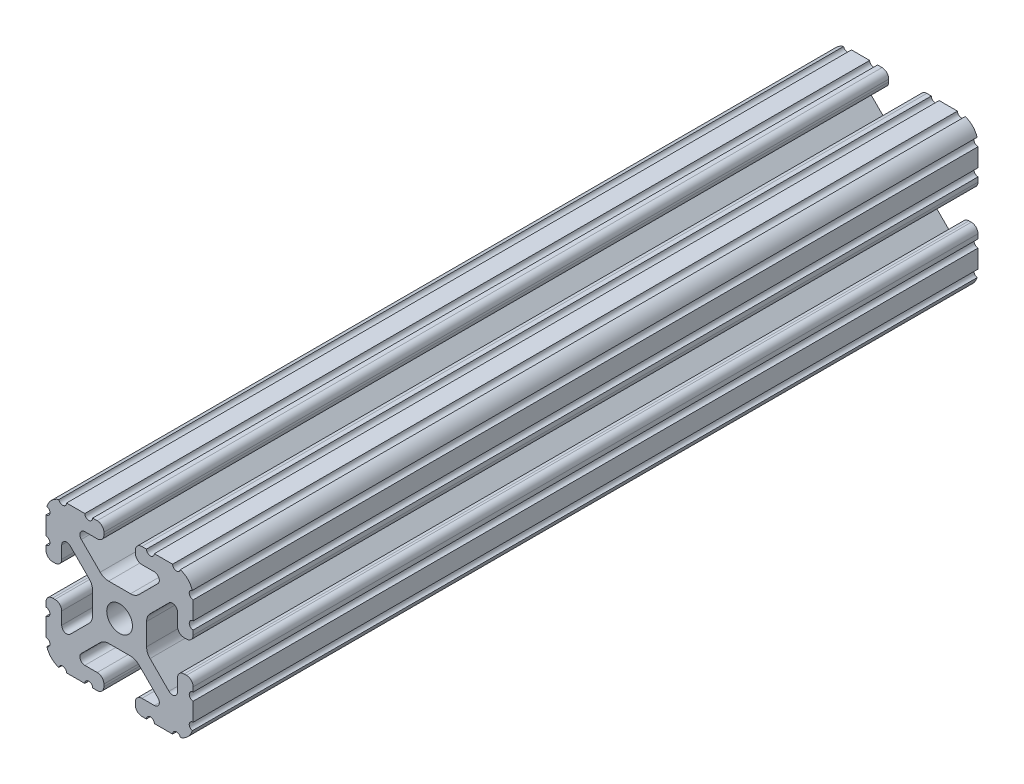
SolidWorks part; units mm, degrees
ref_plane "Front Plane" through (0, 0, 0) normal (0, 0, 1) x (1, 0, 0)
ref_plane "Top Plane" through (0, 0, 0) normal (0, 1, 0) x (1, 0, 0)
ref_plane "Right Plane" through (0, 0, 0) normal (1, 0, 0) x (0, 0, -1)
sketch "Sketch2" plane through (0, 0, 0) normal (0, 0, 1) x (1, 0, 0)
  line L0 (0, 19.05) -> (0, -19.05) construction
  line L1 (-19.05, 0) -> (19.05, 0) construction
  line L2 (4.064, -19.05) -> (19.05, -19.05)
  line L3 (19.05, -19.05) -> (19.05, -4.064)
  line L4 (4.064, -19.05) -> (4.064, -14.986)
  line L5 (4.064, -14.986) -> (12.1123, -14.986)
  line L6 (12.1123, -14.986) -> (4.1113, -6.985)
  line L7 (0, 0) -> (19.05, -19.05) construction
  line L8 (19.05, -4.064) -> (14.986, -4.064)
  line L9 (14.986, -4.064) -> (14.986, -12.1123)
  line L10 (14.986, -12.1123) -> (6.985, -4.1113)
  circle A0 centre (0, 0) radius 3.3274
  arc A1 (8.9963, -14.986) -> (9.909, -12.7826) centre (8.9963, -13.6953) ccw construction
  point P8 (0, -6.985)
sketch "Sketch3" plane through (0, 0, 0) normal (1, 0, 0) x (0, 0, -1)
  line L0 (-457.2, -19.05) -> (457.2, -19.05) construction
  line L1 (-431.8, 0) -> (431.8, 0) construction
sketch "Sketch4" plane through (0, 0, 0) normal (0, 0, 1) x (1, 0, 0)
  line L0 (5.7912, -19.05) -> (14.3002, -19.05)
  line L1 (4.064, -19.05) -> (19.05, -19.05) construction
  line L2 (4.064, -19.05) -> (4.064, -14.986) construction
  line L3 (4.064, -14.986) -> (12.1123, -14.986) construction
  line L4 (4.064, -16.7132) -> (4.064, -17.3228)
  line L5 (5.7912, -14.986) -> (8.9963, -14.986)
  line L6 (0, -6.985) -> (2.833, -6.985)
  line L7 (12.1123, -14.986) -> (4.1113, -6.985) construction
  line L8 (5.0152, -7.8889) -> (9.909, -12.7826)
  line L9 (19.05, -19.05) -> (19.05, -4.064) construction
  line L10 (14.986, -12.1123) -> (6.985, -4.1113) construction
  line L11 (14.986, -4.064) -> (14.986, -12.1123) construction
  line L12 (14.986, -8.9963) -> (14.986, -5.7912)
  line L13 (19.05, -4.064) -> (14.986, -4.064) construction
  line L14 (16.7132, -4.064) -> (17.3228, -4.064)
  line L15 (19.05, -5.7912) -> (19.05, -14.3002)
  line L16 (12.7826, -9.909) -> (7.8889, -5.0152)
  line L17 (6.985, 0) -> (6.985, -2.833)
  line L18 (-19.05, 0) -> (19.05, 0) construction
  line L19 (0, -6.985) -> (0, -3.3274)
  line L20 (0, 19.05) -> (0, -19.05) construction
  line L21 (6.985, 0) -> (3.3274, 0)
  arc A0 (4.064, -17.3228) -> (5.7912, -19.05) centre (5.7912, -17.3228) ccw
  arc A2 (4.064, -16.7132) -> (5.7912, -14.986) centre (5.7912, -16.7132) cw
  arc A3 (8.9963, -14.986) -> (9.909, -12.7826) centre (8.9963, -13.6953) ccw
  arc A4 (2.833, -6.985) -> (5.0152, -7.8889) centre (2.833, -10.0711) cw
  arc A5 (14.3002, -19.05) -> (19.05, -14.3002) centre (14.3002, -14.3002) ccw
  arc A6 (12.7826, -9.909) -> (14.986, -8.9963) centre (13.6953, -8.9963) ccw
  arc A7 (14.986, -5.7912) -> (16.7132, -4.064) centre (16.7132, -5.7912) cw
  arc A8 (17.3228, -4.064) -> (19.05, -5.7912) centre (17.3228, -5.7912) cw
  arc A9 (7.8889, -5.0152) -> (6.985, -2.833) centre (10.0711, -2.833) cw
  circle A10 centre (0, 0) radius 3.3274 construction
  arc A11 (0, -3.3274) -> (3.3274, 0) centre (0, 0) ccw
extrude "Boss-Extrude1" add sketch "Sketch4" along normal mid plane 914.4
sketch "Sketch5" plane through (0, 0, 0) normal (0, 0, 1) x (1, 0, 0)
  line L0 (4.064, -19.05) -> (19.05, -19.05) construction
  line L1 (5.7912, -14.986) -> (8.9963, -14.986) construction
  line L3 (0, 0) -> (19.05, -19.05) construction
  line L4 (8.9963, -14.986) -> (8.9963, -19.05) construction
  line L5 (12.1123, -14.986) -> (4.1113, -6.985) construction
  circle A0 centre (14.7395, -19.05) radius 1.016
  circle A1 centre (7.9803, -19.05) radius 1.016
  circle A2 centre (19.05, -14.7395) radius 1.016
  circle A3 centre (19.05, -7.9803) radius 1.016
  point P10 (7.3938, -14.986)
  point P12 (13.6953, -8.9963)
extrude "Cut-Extrude1" cut sketch "Sketch5" against normal through all both and the other way through all
mirror "Mirror1" about plane through (0, 0, 0) normal (1, 0, 0)
mirror "Mirror2" about plane through (0, 0, 0) normal (0, 1, 0)
sketch "Sketch6" plane through (0, 0, 457.2) normal (0, 0, 1) x (1, 0, 0)
  line L1 (19.5673, -19.4887) -> (-19.5673, -19.4887)
  line L2 (19.5673, -19.4887) -> (19.5673, 19.4887)
  line L3 (19.5673, 19.4887) -> (-19.5673, 19.4887)
  line L4 (-19.5673, -19.4887) -> (-19.5673, 19.4887)
  line L5 (19.5673, -19.4887) -> (-19.5673, 19.4887) construction
  line L6 (19.5673, 19.4887) -> (-19.5673, -19.4887) construction
  point P0 (0, 0)
extrude "Cut-Extrude2" cut sketch "Sketch6" against normal offset from surface (711.2 mm away) 203.2
equation "\"D1@Boss-Extrude1\"=\"Length@Sketch3\""
equation "\"D1@Sketch2\"=\"Thickness@Sketch2\""
equation "\"D2@Sketch4\"=\"Slot Inner Width@Sketch2\"*0.15"
equation "\"D1@Sketch4\"=\"D3@Sketch4\"*2.75"
equation "\"D3@Sketch4\"=\"Thickness@Sketch2\"*0.425"
equation "\"D1@Sketch5\"=\"Thickness@Sketch2\"*0.5"
